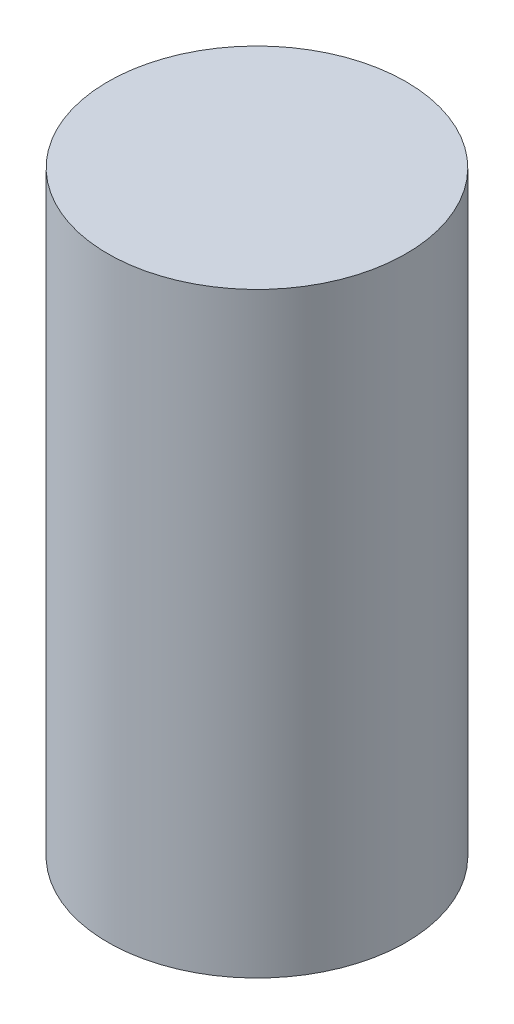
SolidWorks part; units mm, degrees
ref_plane "Plan de face" through (0, 0, 0) normal (0, 0, 1) x (1, 0, 0)
ref_plane "Plan de dessus" through (0, 0, 0) normal (0, 1, 0) x (1, 0, 0)
ref_plane "Plan de droite" through (0, 0, 0) normal (1, 0, 0) x (0, 0, -1)
sketch "Esquisse1" plane through (0, 0, 0) normal (0, 0, 1) x (1, 0, 0)
  line L1 (0, 0) -> (1.5, 0)
  line L2 (0, 0) -> (0, 6)
  line L3 (0, 6) -> (1.5, 6)
  line L4 (1.5, 0) -> (1.5, 6)
  dimension "D1" = 1.5
  dimension "D2" = 6
revolve "Révolution1" add sketch "Esquisse1" angle 360 about L2
